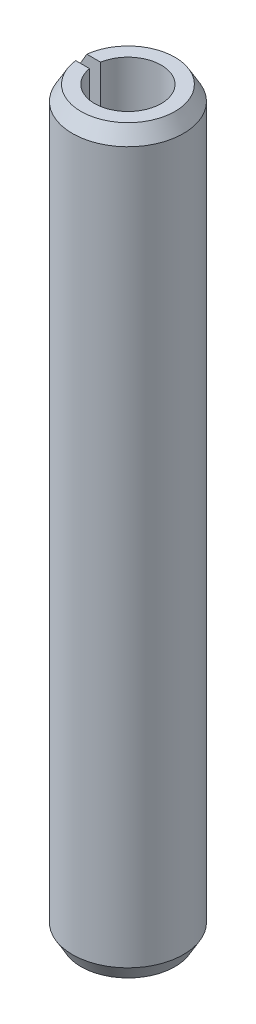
SolidWorks part; units mm, degrees
revolve "Base-Révolution" add sketch "Esquisse1" angle 360 about L0
sketch "Esquisse1" plane through (0, 0, 0) normal (0, 0, 1) x (1, 0, 0)
  line L0 (0, 0) -> (0, 20) construction
  line L1 (1.5, 0) -> (-1.5, 0) construction
  line L2 (0.9, 0) -> (1.5, 0)
  line L3 (0.9, 0) -> (0.9, 20)
  line L4 (0.9, 20) -> (1.5, 20)
  line L5 (1.5, 0) -> (1.5, 20)
chamfer "Chanfrein1" distance 2 angle 30
ref_plane "Plan1" through (0, 0, 0) normal (0, 0, 1) x (1, 0, 0)
ref_plane "Plan2" through (0, 0, 0) normal (0, 1, 0) x (1, 0, 0)
ref_plane "Plan3" through (0, 0, 0) normal (1, 0, 0) x (0, 0, -1)
sketch "Esquisse2" plane through (0, 20, 0) normal (0, 1, 0) x (-1, 0, 0)
  line L0 (0, 0) -> (1.5, 0) construction
  line L1 (0, 0.15) -> (0, -0.15)
  line L2 (0, -0.15) -> (1.5, -0.15)
  line L3 (1.5, 0.15) -> (1.5, -0.15)
  line L4 (0, 0.15) -> (1.5, 0.15)
  circle A0 centre (0, 0) radius 1.5 construction
extrude "Enlèv. mat.-Extru.1" cut sketch "Esquisse2" against normal through all
equation "\"Rn@Esquisse1\" = \"Diamètre nominal@Esquisse1\"/2"
equation "\"Frep@Esquisse2\" = \"Rn@Esquisse1\"*0.1"
equation "\"Ch@Chanfrein1\" = \"Epaisseur@Esquisse1\"/1.5"
